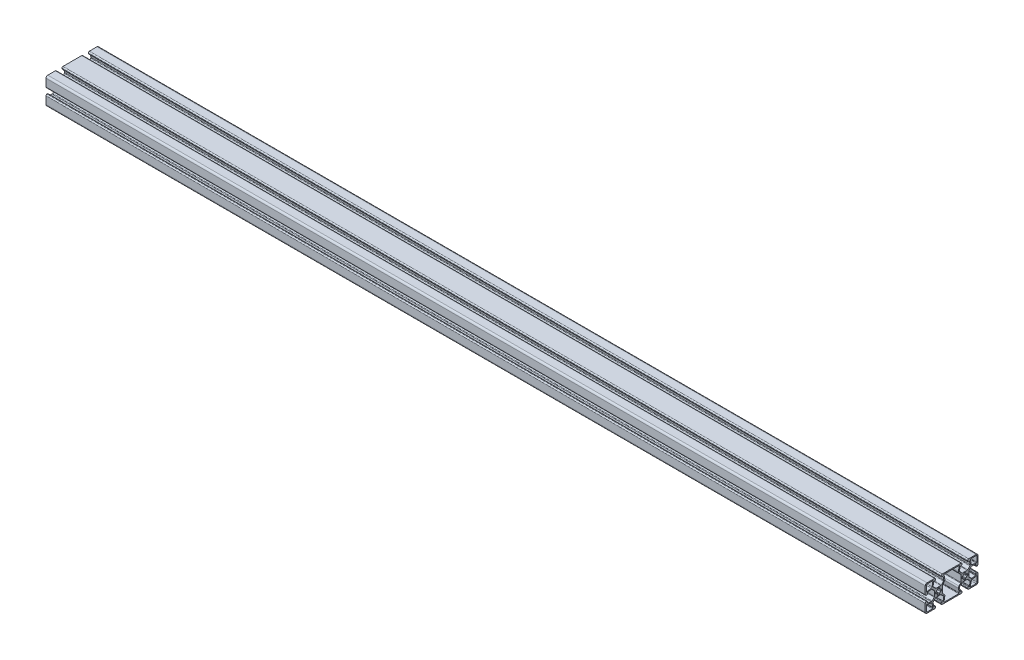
SolidWorks part; units mm, degrees
ref_plane "正面" through (0, 0, 0) normal (0, 0, 1) x (1, 0, 0)
ref_plane "平面" through (0, 0, 0) normal (0, 1, 0) x (1, 0, 0)
ref_plane "右側面" through (0, 0, 0) normal (1, 0, 0) x (0, 0, -1)
sketch "ｽｹｯﾁ1" plane through (0, 0, 0) normal (1, 0, 0) x (0, 0, -1)
  line L0 (2.6716, 4.5) -> (-2.6716, 4.5)
  line L1 (2.6716, -4.5) -> (-2.6716, -4.5)
  line L2 (-13.8, -12.8) -> (-13.8, -6.6497)
  line L3 (-15, -13) -> (-15, -4.35)
  line L4 (-6.0721, -8.0894) -> (-5.3672, -12.0868)
  line L5 (-7.2888, -8.0999) -> (-6.549, -12.2952)
  line L6 (-13, -15) -> (-4.35, -15)
  line L7 (-12.8, -13.8) -> (-6.6497, -13.8)
  line L8 (-3.15, -13.8) -> (-3.15, -13.25)
  line L9 (-3.9, -12.5) -> (-4.8748, -12.5)
  line L10 (-6.0721, 8.0894) -> (-5.3672, 12.0868)
  line L11 (-7.2888, 8.0999) -> (-6.549, 12.2952)
  line L12 (-15, 13) -> (-15, 4.35)
  line L13 (-13.8, 12.8) -> (-13.8, 6.6497)
  line L14 (-3.5, -0.5) -> (-3.5, 0.5)
  line L15 (-4.5, -2.6716) -> (-4.5, 2.6716)
  line L16 (-8.0999, -7.2888) -> (-12.2952, -6.549)
  line L17 (-8.0894, -6.0721) -> (-12.0868, -5.3672)
  line L18 (-12.5, -4.8748) -> (-12.5, -3.9)
  line L19 (-13.25, -3.15) -> (-13.8, -3.15)
  line L20 (-4.7929, -3.3787) -> (-7.2086, -5.7944)
  line L21 (-3.3787, -4.7929) -> (-5.7944, -7.2086)
  line L22 (-2.6557, -1) -> (-3, -1)
  line L23 (-8.0999, 7.2888) -> (-12.2952, 6.549)
  line L24 (-8.0894, 6.0721) -> (-12.0868, 5.3672)
  line L25 (-12.5, 4.8748) -> (-12.5, 3.9)
  line L26 (-13.25, 3.15) -> (-13.8, 3.15)
  line L27 (-3.3787, 4.7929) -> (-5.7944, 7.2086)
  line L28 (-4.7929, 3.3787) -> (-7.2086, 5.7944)
  line L29 (-2.6557, 1) -> (-3, 1)
  line L30 (-13, 15) -> (-4.35, 15)
  line L31 (-12.8, 13.8) -> (-6.6497, 13.8)
  line L32 (-3.15, 13.8) -> (-3.15, 13.25)
  line L33 (-3.9, 12.5) -> (-4.8748, 12.5)
  line L34 (36.0721, -8.0894) -> (35.3672, -12.0868)
  line L35 (37.2888, -8.0999) -> (36.549, -12.2952)
  line L36 (45, -13) -> (45, -4.35)
  line L37 (43.8, -12.8) -> (43.8, -6.6497)
  line L38 (22.7461, -8.2977) -> (23.6128, -13.2132)
  line L39 (23.9279, -8.0894) -> (24.6328, -12.0868)
  line L40 (6.0721, -8.0894) -> (5.3672, -12.0868)
  line L41 (7.2539, -8.2977) -> (6.549, -12.2952)
  line L42 (25.65, -15) -> (4.35, -15)
  line L43 (23.1204, -13.8) -> (6.6497, -13.8)
  line L44 (3.9, -12.5) -> (4.8748, -12.5)
  line L45 (3.15, -13.8) -> (3.15, -13.25)
  line L46 (26.1, -12.5) -> (25.1252, -12.5)
  line L47 (26.85, -13.8) -> (26.85, -13.25)
  line L48 (43, -15) -> (34.35, -15)
  line L49 (42.8, -13.8) -> (36.6497, -13.8)
  line L50 (33.9, -12.5) -> (34.8748, -12.5)
  line L51 (33.15, -13.8) -> (33.15, -13.25)
  line L52 (32.6716, 4.5) -> (27.3284, 4.5)
  line L53 (32.6716, -4.5) -> (27.3284, -4.5)
  line L54 (23.9279, 8.0894) -> (24.6328, 12.0868)
  line L55 (22.7461, 8.2977) -> (23.451, 12.2952)
  line L56 (6.0721, 8.0894) -> (5.3672, 12.0868)
  line L57 (7.2539, 8.2977) -> (6.549, 12.2952)
  line L58 (3.5, -0.5) -> (3.5, 0.5)
  line L59 (4.5, -3.8029) -> (4.5, 3.8029)
  line L60 (4.7929, -4.5101) -> (6.6429, -6.3601)
  line L61 (3.3787, -4.7929) -> (5.7944, -7.2086)
  line L62 (0.5, -3.5) -> (-0.5, -3.5)
  line L63 (-1, -2.6557) -> (-1, -3)
  line L64 (1, -2.6557) -> (1, -3)
  line L65 (2.6557, -1) -> (3, -1)
  line L66 (4.7929, 4.5101) -> (6.6429, 6.3601)
  line L67 (3.3787, 4.7929) -> (5.7944, 7.2086)
  line L68 (-1, 2.6557) -> (-1, 3)
  line L69 (1, 2.6557) -> (1, 3)
  line L70 (0.5, 3.5) -> (-0.5, 3.5)
  line L71 (2.6557, 1) -> (3, 1)
  line L72 (26.5, -0.5) -> (26.5, 0.5)
  line L73 (25.5, -3.8029) -> (25.5, 3.8029)
  line L74 (25.2071, -4.5101) -> (23.3571, -6.3601)
  line L75 (26.6213, -4.7929) -> (24.2056, -7.2086)
  line L76 (27.3443, -1) -> (27, -1)
  line L77 (29, -2.6557) -> (29, -3)
  line L78 (30.5, -3.5) -> (29.5, -3.5)
  line L79 (25.2071, 4.5101) -> (23.3571, 6.3601)
  line L80 (26.6213, 4.7929) -> (24.2056, 7.2086)
  line L81 (29, 2.6557) -> (29, 3)
  line L82 (30.5, 3.5) -> (29.5, 3.5)
  line L83 (27.3443, 1) -> (27, 1)
  line L84 (25.65, 15) -> (4.35, 15)
  line L85 (23.3503, 13.8) -> (6.6497, 13.8)
  line L86 (3.9, 12.5) -> (4.8748, 12.5)
  line L87 (3.15, 13.8) -> (3.15, 13.25)
  line L88 (26.1, 12.5) -> (25.1252, 12.5)
  line L89 (26.85, 13.8) -> (26.85, 13.25)
  line L90 (45, 13) -> (45, 4.35)
  line L91 (43.8, 12.8) -> (43.8, 6.8796)
  line L92 (36.0721, 8.0894) -> (35.3672, 12.0868)
  line L93 (37.2888, 8.0999) -> (36.3872, 13.2132)
  line L94 (33.5, -0.5) -> (33.5, 0.5)
  line L95 (34.5, -2.6716) -> (34.5, 2.6716)
  line L96 (38.0894, -6.0721) -> (42.0868, -5.3672)
  line L97 (38.0999, -7.2888) -> (42.2952, -6.549)
  line L98 (34.7929, -3.3787) -> (37.2086, -5.7944)
  line L99 (33.3787, -4.7929) -> (35.7944, -7.2086)
  line L100 (32.6557, -1) -> (33, -1)
  line L101 (31, -2.6557) -> (31, -3)
  line L102 (42.5, -4.8748) -> (42.5, -3.9)
  line L103 (43.25, -3.15) -> (43.8, -3.15)
  line L104 (38.0894, 6.0721) -> (42.0868, 5.3672)
  line L105 (38.0999, 7.2888) -> (43.2132, 6.3872)
  line L106 (33.3787, 4.7929) -> (35.7944, 7.2086)
  line L107 (31, 2.6557) -> (31, 3)
  line L108 (32.6557, 1) -> (33, 1)
  line L109 (34.7929, 3.3787) -> (37.2086, 5.7944)
  line L110 (42.5, 4.8748) -> (42.5, 3.9)
  line L111 (43.25, 3.15) -> (43.8, 3.15)
  line L112 (43, 15) -> (34.35, 15)
  line L113 (42.8, 13.8) -> (36.8796, 13.8)
  line L114 (33.9, 12.5) -> (34.8748, 12.5)
  line L115 (33.15, 13.8) -> (33.15, 13.25)
  arc A0 (-2.2203, -1.2541) -> (-1.2541, -2.2203) centre (0, 0) ccw
  arc A1 (-2.2203, -1.2541) -> (-2.6557, -1) centre (-2.6557, -1.5) ccw
  arc A2 (-2.6557, 1) -> (-2.2203, 1.2541) centre (-2.6557, 1.5) ccw
  arc A3 (-1.2541, 2.2203) -> (-2.2203, 1.2541) centre (0, 0) ccw
  arc A4 (-15, -13) -> (-13, -15) centre (-13, -13) ccw
  arc A5 (-13.8, -12.8) -> (-12.8, -13.8) centre (-12.8, -12.8) ccw
  arc A6 (-6.6497, -13.8) -> (-6.2463, -13.0045) centre (-6.6497, -13.3) ccw
  arc A7 (-6.549, -12.2952) -> (-6.2463, -13.0045) centre (-4.8748, -12) ccw
  arc A8 (-5.3672, -12.0868) -> (-4.8748, -12.5) centre (-4.8748, -12) ccw
  arc A9 (-4.35, -15) -> (-3.15, -13.8) centre (-4.35, -13.8) ccw
  arc A10 (-3.15, -13.25) -> (-3.9, -12.5) centre (-3.9, -13.25) ccw
  arc A11 (-13.0045, -6.2463) -> (-13.8, -6.6497) centre (-13.3, -6.6497) ccw
  arc A12 (-13.0045, -6.2463) -> (-12.2952, -6.549) centre (-12, -4.8748) ccw
  arc A13 (-13.8, -3.15) -> (-15, -4.35) centre (-13.8, -4.35) ccw
  arc A14 (-12.5, -3.9) -> (-13.25, -3.15) centre (-13.25, -3.9) ccw
  arc A15 (-12.5, -4.8748) -> (-12.0868, -5.3672) centre (-12, -4.8748) ccw
  arc A16 (-7.2888, -8.0999) -> (-8.0999, -7.2888) centre (-8.2736, -8.2736) ccw
  arc A17 (-8.0894, -6.0721) -> (-7.2086, -5.7944) centre (-7.9157, -5.0873) ccw
  arc A18 (-5.7944, -7.2086) -> (-6.0721, -8.0894) centre (-5.0873, -7.9157) ccw
  arc A19 (-4.7929, -3.3787) -> (-4.5, -2.6716) centre (-5.5, -2.6716) ccw
  arc A20 (-2.6716, -4.5) -> (-3.3787, -4.7929) centre (-2.6716, -5.5) ccw
  arc A21 (-3.5, -0.5) -> (-3, -1) centre (-3, -0.5) ccw
  arc A22 (-15, 4.35) -> (-13.8, 3.15) centre (-13.8, 4.35) ccw
  arc A23 (-13.25, 3.15) -> (-12.5, 3.9) centre (-13.25, 3.9) ccw
  arc A24 (-12.0868, 5.3672) -> (-12.5, 4.8748) centre (-12, 4.8748) ccw
  arc A25 (-7.2086, 5.7944) -> (-8.0894, 6.0721) centre (-7.9157, 5.0873) ccw
  arc A26 (-4.5, 2.6716) -> (-4.7929, 3.3787) centre (-5.5, 2.6716) ccw
  arc A27 (-3.3787, 4.7929) -> (-2.6716, 4.5) centre (-2.6716, 5.5) ccw
  arc A28 (-3, 1) -> (-3.5, 0.5) centre (-3, 0.5) ccw
  arc A29 (-8.0999, 7.2888) -> (-7.2888, 8.0999) centre (-8.2736, 8.2736) ccw
  arc A30 (-6.0721, 8.0894) -> (-5.7944, 7.2086) centre (-5.0873, 7.9157) ccw
  arc A31 (-13, 15) -> (-15, 13) centre (-13, 13) ccw
  arc A32 (-12.8, 13.8) -> (-13.8, 12.8) centre (-12.8, 12.8) ccw
  arc A33 (-6.2463, 13.0045) -> (-6.549, 12.2952) centre (-4.8748, 12) ccw
  arc A34 (-6.2463, 13.0045) -> (-6.6497, 13.8) centre (-6.6497, 13.3) ccw
  arc A35 (-4.8748, 12.5) -> (-5.3672, 12.0868) centre (-4.8748, 12) ccw
  arc A36 (-3.15, 13.8) -> (-4.35, 15) centre (-4.35, 13.8) ccw
  arc A37 (-3.9, 12.5) -> (-3.15, 13.25) centre (-3.9, 13.25) ccw
  arc A38 (6.2463, -13.0045) -> (6.6497, -13.8) centre (6.6497, -13.3) ccw
  arc A39 (3.15, -13.8) -> (4.35, -15) centre (4.35, -13.8) ccw
  arc A40 (3.9, -12.5) -> (3.15, -13.25) centre (3.9, -13.25) ccw
  arc A41 (4.8748, -12.5) -> (5.3672, -12.0868) centre (4.8748, -12) ccw
  arc A42 (6.2463, -13.0045) -> (6.549, -12.2952) centre (4.8748, -12) ccw
  arc A43 (25.65, -15) -> (26.85, -13.8) centre (25.65, -13.8) ccw
  arc A44 (26.85, -13.25) -> (26.1, -12.5) centre (26.1, -13.25) ccw
  arc A45 (23.1204, -13.8) -> (23.6128, -13.2132) centre (23.1204, -13.3) ccw
  arc A46 (24.6328, -12.0868) -> (25.1252, -12.5) centre (25.1252, -12) ccw
  arc A47 (33.15, -13.8) -> (34.35, -15) centre (34.35, -13.8) ccw
  arc A48 (33.9, -12.5) -> (33.15, -13.25) centre (33.9, -13.25) ccw
  arc A49 (34.8748, -12.5) -> (35.3672, -12.0868) centre (34.8748, -12) ccw
  arc A50 (36.2463, -13.0045) -> (36.549, -12.2952) centre (34.8748, -12) ccw
  arc A51 (36.2463, -13.0045) -> (36.6497, -13.8) centre (36.6497, -13.3) ccw
  arc A52 (42.8, -13.8) -> (43.8, -12.8) centre (42.8, -12.8) ccw
  arc A53 (43, -15) -> (45, -13) centre (43, -13) ccw
  arc A54 (31, 3) -> (30.5, 3.5) centre (30.5, 3) ccw
  arc A55 (30.5, -3.5) -> (31, -3) centre (30.5, -3) ccw
  arc A56 (6.0721, -8.0894) -> (5.7944, -7.2086) centre (5.0873, -7.9157) ccw
  arc A57 (1.2541, -2.2203) -> (2.2203, -1.2541) centre (0, 0) ccw
  arc A58 (-1, -3) -> (-0.5, -3.5) centre (-0.5, -3) ccw
  arc A59 (0.5, -3.5) -> (1, -3) centre (0.5, -3) ccw
  arc A60 (1.2541, -2.2203) -> (1, -2.6557) centre (1.5, -2.6557) ccw
  arc A61 (-1, -2.6557) -> (-1.2541, -2.2203) centre (-1.5, -2.6557) ccw
  arc A62 (3.3787, -4.7929) -> (2.6716, -4.5) centre (2.6716, -5.5) ccw
  arc A63 (4.5, -3.8029) -> (4.7929, -4.5101) centre (5.5, -3.8029) ccw
  arc A64 (2.6557, -1) -> (2.2203, -1.2541) centre (2.6557, -1.5) ccw
  arc A65 (3, -1) -> (3.5, -0.5) centre (3, -0.5) ccw
  arc A66 (7.2539, -8.2977) -> (6.6429, -6.3601) centre (5.0873, -7.9157) ccw
  arc A67 (5.7944, 7.2086) -> (6.0721, 8.0894) centre (5.0873, 7.9157) ccw
  arc A68 (2.2203, 1.2541) -> (1.2541, 2.2203) centre (0, 0) ccw
  arc A69 (1, 3) -> (0.5, 3.5) centre (0.5, 3) ccw
  arc A70 (-0.5, 3.5) -> (-1, 3) centre (-0.5, 3) ccw
  arc A71 (1, 2.6557) -> (1.2541, 2.2203) centre (1.5, 2.6557) ccw
  arc A72 (-1.2541, 2.2203) -> (-1, 2.6557) centre (-1.5, 2.6557) ccw
  arc A73 (2.6716, 4.5) -> (3.3787, 4.7929) centre (2.6716, 5.5) ccw
  arc A74 (4.7929, 4.5101) -> (4.5, 3.8029) centre (5.5, 3.8029) ccw
  arc A75 (2.2203, 1.2541) -> (2.6557, 1) centre (2.6557, 1.5) ccw
  arc A76 (3.5, 0.5) -> (3, 1) centre (3, 0.5) ccw
  arc A77 (23.3571, -6.3601) -> (22.7461, -8.2977) centre (24.9127, -7.9157) ccw
  arc A78 (24.2056, -7.2086) -> (23.9279, -8.0894) centre (24.9127, -7.9157) ccw
  arc A79 (26.5, -0.5) -> (27, -1) centre (27, -0.5) ccw
  arc A80 (25.2071, -4.5101) -> (25.5, -3.8029) centre (24.5, -3.8029) ccw
  arc A81 (29, -3) -> (29.5, -3.5) centre (29.5, -3) ccw
  arc A82 (27.3284, -4.5) -> (26.6213, -4.7929) centre (27.3284, -5.5) ccw
  arc A83 (27.7797, -1.2541) -> (27.3443, -1) centre (27.3443, -1.5) ccw
  arc A84 (29, -2.6557) -> (28.7459, -2.2203) centre (28.5, -2.6557) ccw
  arc A85 (27.7797, -1.2541) -> (28.7459, -2.2203) centre (30, 0) ccw
  arc A86 (27, 1) -> (26.5, 0.5) centre (27, 0.5) ccw
  arc A87 (25.5, 3.8029) -> (25.2071, 4.5101) centre (24.5, 3.8029) ccw
  arc A88 (29.5, 3.5) -> (29, 3) centre (29.5, 3) ccw
  arc A89 (26.6213, 4.7929) -> (27.3284, 4.5) centre (27.3284, 5.5) ccw
  arc A90 (27.3443, 1) -> (27.7797, 1.2541) centre (27.3443, 1.5) ccw
  arc A91 (28.7459, 2.2203) -> (27.7797, 1.2541) centre (30, 0) ccw
  arc A92 (28.7459, 2.2203) -> (29, 2.6557) centre (28.5, 2.6557) ccw
  arc A93 (22.7461, 8.2977) -> (23.3571, 6.3601) centre (24.9127, 7.9157) ccw
  arc A94 (23.9279, 8.0894) -> (24.2056, 7.2086) centre (24.9127, 7.9157) ccw
  arc A95 (6.6497, 13.8) -> (6.2463, 13.0045) centre (6.6497, 13.3) ccw
  arc A96 (3.15, 13.25) -> (3.9, 12.5) centre (3.9, 13.25) ccw
  arc A97 (5.3672, 12.0868) -> (4.8748, 12.5) centre (4.8748, 12) ccw
  arc A98 (4.35, 15) -> (3.15, 13.8) centre (4.35, 13.8) ccw
  arc A99 (6.549, 12.2952) -> (6.2463, 13.0045) centre (4.8748, 12) ccw
  arc A100 (26.1, 12.5) -> (26.85, 13.25) centre (26.1, 13.25) ccw
  arc A101 (26.85, 13.8) -> (25.65, 15) centre (25.65, 13.8) ccw
  arc A102 (25.1252, 12.5) -> (24.6328, 12.0868) centre (25.1252, 12) ccw
  arc A103 (23.7537, 13.0045) -> (23.451, 12.2952) centre (25.1252, 12) ccw
  arc A104 (23.7537, 13.0045) -> (23.3503, 13.8) centre (23.3503, 13.3) ccw
  arc A105 (36.0721, -8.0894) -> (35.7944, -7.2086) centre (35.0873, -7.9157) ccw
  arc A106 (38.0999, -7.2888) -> (37.2888, -8.0999) centre (38.2736, -8.2736) ccw
  arc A107 (37.2086, -5.7944) -> (38.0894, -6.0721) centre (37.9157, -5.0873) ccw
  arc A108 (34.5, -2.6716) -> (34.7929, -3.3787) centre (35.5, -2.6716) ccw
  arc A109 (31.2541, -2.2203) -> (31, -2.6557) centre (31.5, -2.6557) ccw
  arc A110 (33.3787, -4.7929) -> (32.6716, -4.5) centre (32.6716, -5.5) ccw
  arc A111 (33, -1) -> (33.5, -0.5) centre (33, -0.5) ccw
  arc A112 (32.6557, -1) -> (32.2203, -1.2541) centre (32.6557, -1.5) ccw
  arc A113 (31.2541, -2.2203) -> (32.2203, -1.2541) centre (30, 0) ccw
  arc A114 (42.2952, -6.549) -> (43.0045, -6.2463) centre (42, -4.8748) ccw
  arc A115 (43.8, -6.6497) -> (43.0045, -6.2463) centre (43.3, -6.6497) ccw
  arc A116 (43.25, -3.15) -> (42.5, -3.9) centre (43.25, -3.9) ccw
  arc A117 (42.0868, -5.3672) -> (42.5, -4.8748) centre (42, -4.8748) ccw
  arc A118 (45, -4.35) -> (43.8, -3.15) centre (43.8, -4.35) ccw
  arc A119 (38.0894, 6.0721) -> (37.2086, 5.7944) centre (37.9157, 5.0873) ccw
  arc A120 (34.7929, 3.3787) -> (34.5, 2.6716) centre (35.5, 2.6716) ccw
  arc A121 (32.6716, 4.5) -> (33.3787, 4.7929) centre (32.6716, 5.5) ccw
  arc A122 (33.5, 0.5) -> (33, 1) centre (33, 0.5) ccw
  arc A123 (32.2203, 1.2541) -> (32.6557, 1) centre (32.6557, 1.5) ccw
  arc A124 (31, 2.6557) -> (31.2541, 2.2203) centre (31.5, 2.6557) ccw
  arc A125 (32.2203, 1.2541) -> (31.2541, 2.2203) centre (30, 0) ccw
  arc A126 (35.7944, 7.2086) -> (36.0721, 8.0894) centre (35.0873, 7.9157) ccw
  arc A127 (37.2888, 8.0999) -> (38.0999, 7.2888) centre (38.2736, 8.2736) ccw
  arc A128 (42.5, 3.9) -> (43.25, 3.15) centre (43.25, 3.9) ccw
  arc A129 (42.5, 4.8748) -> (42.0868, 5.3672) centre (42, 4.8748) ccw
  arc A130 (43.8, 3.15) -> (45, 4.35) centre (43.8, 4.35) ccw
  arc A131 (33.15, 13.25) -> (33.9, 12.5) centre (33.9, 13.25) ccw
  arc A132 (34.35, 15) -> (33.15, 13.8) centre (34.35, 13.8) ccw
  arc A133 (35.3672, 12.0868) -> (34.8748, 12.5) centre (34.8748, 12) ccw
  arc A134 (43.8, 12.8) -> (42.8, 13.8) centre (42.8, 12.8) ccw
  arc A135 (45, 13) -> (43, 15) centre (43, 13) ccw
  arc A136 (6.6429, 6.3601) -> (7.2539, 8.2977) centre (5.0873, 7.9157) ccw
  arc A137 (43.2132, 6.3872) -> (43.8, 6.8796) centre (43.3, 6.8796) ccw
  arc A138 (36.8796, 13.8) -> (36.3872, 13.2132) centre (36.8796, 13.3) ccw
  arc A139 (-12.2952, 6.549) -> (-13.0045, 6.2463) centre (-12, 4.8748) ccw
  arc A140 (-13.8, 6.6497) -> (-13.0045, 6.2463) centre (-13.3, 6.6497) ccw
extrude "ﾎﾞｽ - 押し出し1" add sketch "ｽｹｯﾁ1" along normal blind 1000
